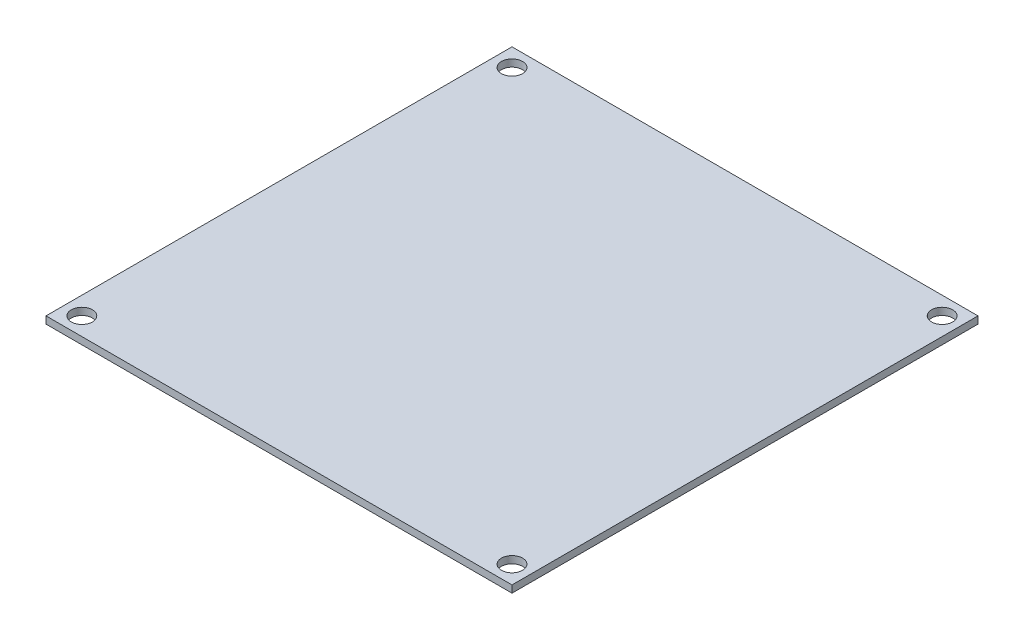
SolidWorks part; units mm, degrees
ref_plane "Front Plane" through (0, 0, 0) normal (0, 0, 1) x (1, 0, 0)
ref_plane "Top Plane" through (0, 0, 0) normal (0, 1, 0) x (1, 0, 0)
ref_plane "Right Plane" through (0, 0, 0) normal (1, 0, 0) x (0, 0, -1)
sketch "Sketch1" plane through (0, 0, 0) normal (0, 1, 0) x (1, 0, 0)
  line L1 (0, 0) -> (65, 0)
  line L2 (0, 0) -> (0, 65)
  line L3 (0, 65) -> (65, 65)
  line L4 (65, 0) -> (65, 65)
  dimension "D1" = 65
  dimension "D2" = 65
extrude "Boss-Extrude1" add sketch "Sketch1" along normal blind 1
sketch "Sketch2" plane through (0, 1, 0) normal (0, 1, 0) x (1, 0, 0)
  line L0 (32.5, 2.5) -> (32.5, 0)
  line L1 (2.5, 62.5) -> (62.5, 62.5)
  line L2 (2.5, 62.5) -> (2.5, 2.5)
  line L3 (2.5, 2.5) -> (62.5, 2.5)
  line L4 (62.5, 62.5) -> (62.5, 2.5)
  line L5 (0, 0) -> (65, 0) construction
  line L6 (2.5, 32.5) -> (0, 32.5)
  line L7 (0, 65) -> (0, 0) construction
  dimension "D1" = 60
  dimension "D2" = 60
hole_wizard "#4 Clearance Hole1" positions "3DSketch1" profile "Sketch3" hole size "#4" standard "ANSI Inch"
sketch3d "3DSketch1"
  point P0 (2.5, 1, -62.5)
  point P3 (62.5, 1, -62.5)
  point P6 (62.5, 1, -2.5)
  point P9 (2.5, 1, -2.5)
sketch "Sketch3" plane through (2.5, 1, -62.5) normal (1, 0, 0) x (0, 0, 1)
  line L0 (0, 0) -> (0, 1)
  line L1 (0, 1) -> (1.4732, 1)
  line L2 (1.4732, 1) -> (1.4732, 0)
  line L5 (1.4732, 0) -> (0, 0)
  line L11 (0, -6.35) -> (0, 107.95) construction
  dimension "Thru Hole Dia." = 2.9464
  dimension "Thru Hole Depth" = 1
